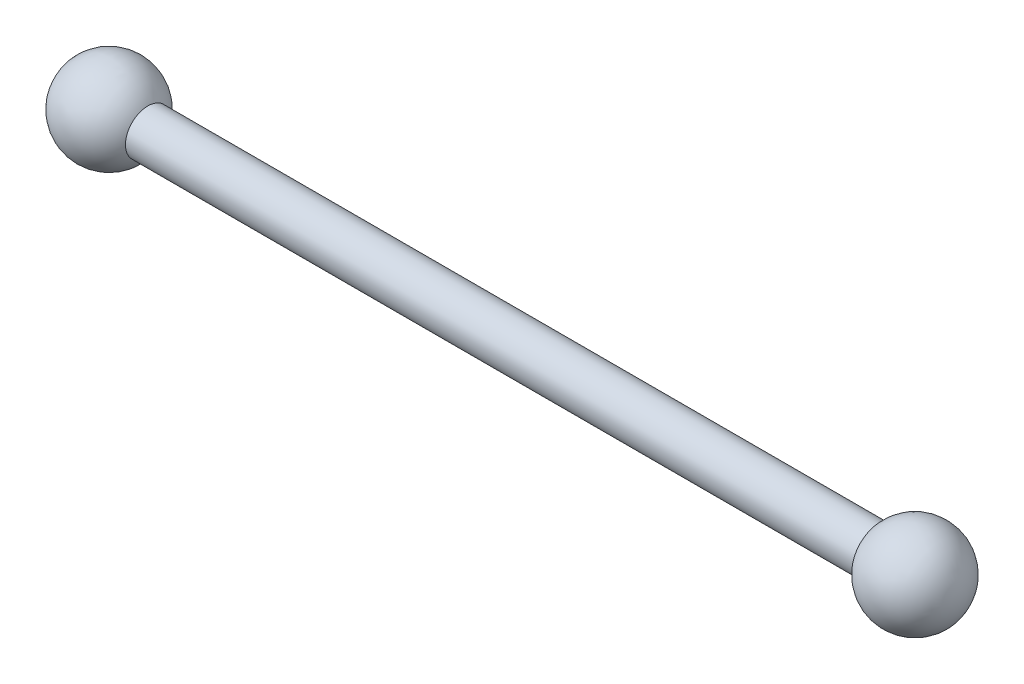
SolidWorks part; units mm, degrees
ref_plane "Plane1" through (0, 0, 0) normal (0, 0, 1) x (1, 0, 0)
ref_plane "Plane2" through (0, 0, 0) normal (0, 1, 0) x (1, 0, 0)
ref_plane "Plane3" through (0, 0, 0) normal (1, 0, 0) x (0, 0, -1)
sketch "Sketch1" plane through (0, 0, 0) normal (0, 0, 1) x (1, 0, 0)
  line L0 (-177.4006, 127.9059) -> (22.5994, 127.9059)
  line L1 (-158.7403, 132.9059) -> (3.9391, 132.9059)
  line L2 (22.5994, 127.9059) -> (-177.4006, 127.9059) construction
  arc A0 (22.5994, 127.9059) -> (3.9391, 132.9059) centre (12.5994, 127.9059) ccw
  arc A1 (-158.7403, 132.9059) -> (-177.4006, 127.9059) centre (-167.4006, 127.9059) ccw
  dimension "D2" = 10
  dimension "D3" = 10
  dimension "D1" = 200
  dimension "D4" = 5
revolve "Base-Revolve" add sketch "Sketch1" angle 360 about L2
ref_point "SphCtr1_LeverArm"
ref_point "SphCtr2_LeverArm"
